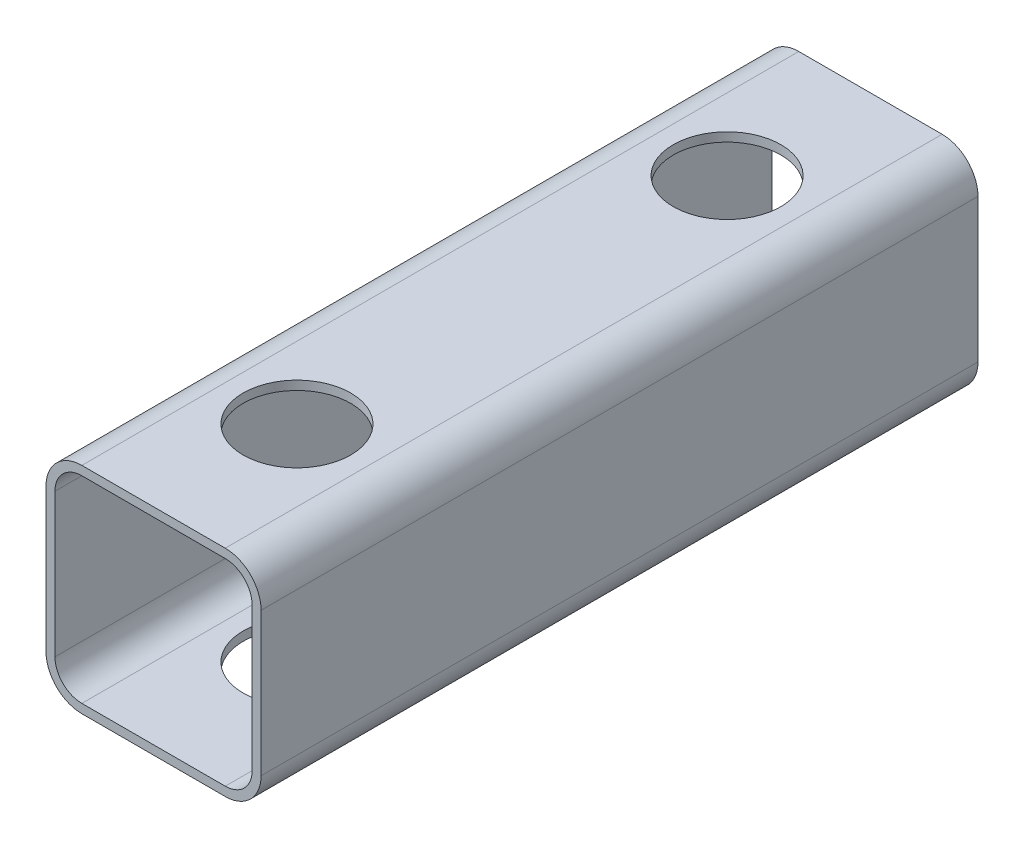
SolidWorks part; units mm, degrees
ref_plane "Front" through (0, 0, 0) normal (0, 0, 1) x (1, 0, 0)
ref_plane "Top" through (0, 0, 0) normal (0, 1, 0) x (1, 0, 0)
ref_plane "Right" through (0, 0, 0) normal (1, 0, 0) x (0, 0, -1)
sketch "Sketch1" plane through (0, 0, 0) normal (0, 0, 1) x (1, 0, 0)
  line L0 (-25.4, 38.1) -> (25.4, 38.1)
  line L1 (-38.1, 25.4) -> (-38.1, -25.4)
  line L2 (25.4, -38.1) -> (-25.4, -38.1)
  line L3 (38.1, -25.4) -> (38.1, 25.4)
  line L4 (0, 38.1) -> (0, -38.1) construction
  arc A0 (38.1, 25.4) -> (25.4, 38.1) centre (25.4, 25.4) ccw
  arc A1 (38.1, -25.4) -> (25.4, -38.1) centre (25.4, -25.4) cw
  arc A2 (-25.4, -38.1) -> (-38.1, -25.4) centre (-25.4, -25.4) cw
  arc A3 (-38.1, 25.4) -> (-25.4, 38.1) centre (-25.4, 25.4) cw
  dimension "D1" = 12.7
  dimension "D2" = 76.2
  dimension "D3" = 76.2
extrude "Base-Extrude-Thin" add sketch "Sketch1" along normal blind 254 thin
sketch "Sketch2" plane through (0, 38.1, 0) normal (0, 1, 0) x (-1, 0, 0)
  line L0 (0, 254) -> (0, 0) construction
  line L1 (25.4, 254) -> (-25.4, 254) construction
  line L2 (0, 127) -> (-107.9666, 127) construction
  circle A0 centre (0, 50.8) radius 19.05
  circle A1 centre (0, 203.2) radius 19.05
  dimension "D1" = 38.1
  dimension "D2" = 152.4
extrude "Cut-Extrude1" cut sketch "Sketch2" against normal through all
